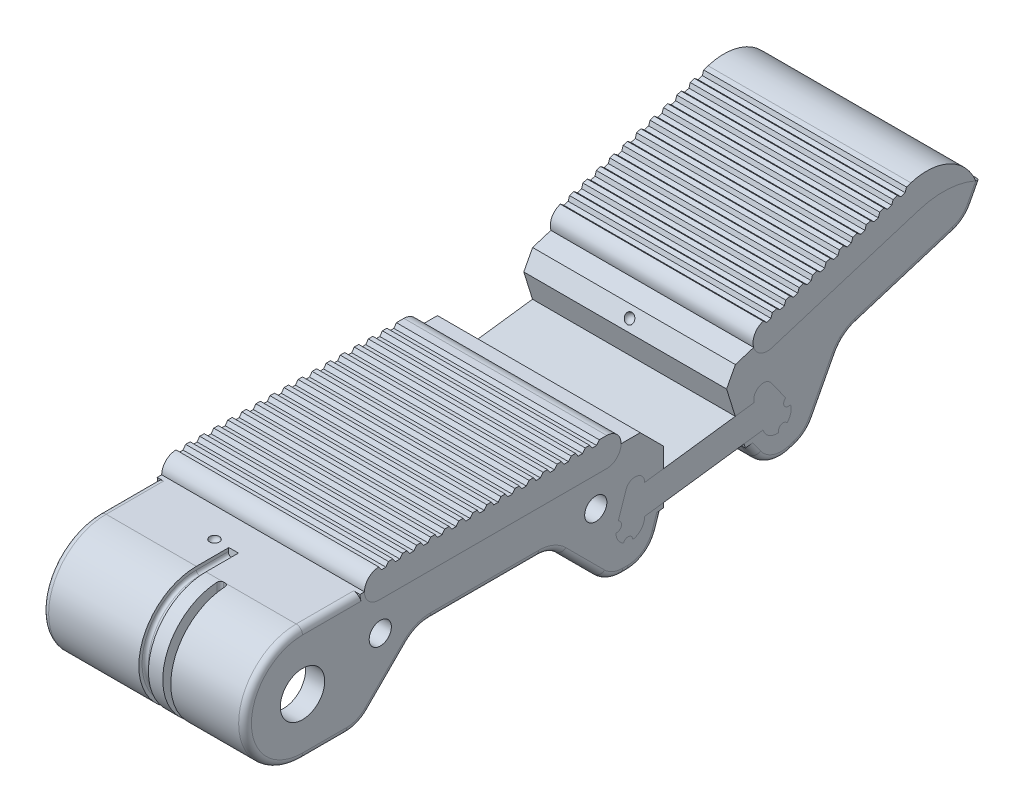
SolidWorks part; units mm, degrees
other "<finger_pivot_print>-<Contouring>"
ref_plane "Front Plane" through (0, 0, 0) normal (0, 0, 1) x (1, 0, 0)
ref_plane "Top Plane" through (0, 0, 0) normal (0, 1, 0) x (1, 0, 0)
ref_plane "Right Plane" through (0, 0, 0) normal (1, 0, 0) x (0, 0, -1)
inserted part "finger_pivot_print"
sketch "Sketch1" plane through (15.875, 0, 0) normal (1, 0, 0) x (0, 0, -1)
  line L4 (53.5721, -2.6914) -> (72.1051, -0.2514)
  line L5 (50.6498, 2.3847) -> (49.4269, -1.2655)
  line L6 (70.731, 4.1672) -> (53.5721, 1.9082)
  line L7 (75.6436, 2.3384) -> (73.3817, 5.4877)
  line L8 (53.5721, -2.6914) -> (72.1051, -0.2514)
  line L9 (50.6498, 2.3847) -> (49.4269, -1.2655)
  line L10 (70.731, 4.1672) -> (53.5721, 1.9082)
  line L11 (75.6436, 2.3384) -> (73.3817, 5.4877)
  line L45 (72.6711, 14.0607) -> (72.1185, 14.4905)
  line L46 (73.3395, 14.2686) -> (72.6711, 14.0607)
  line L47 (73.5509, 14.9359) -> (73.3395, 14.2686)
  line L48 (74.2193, 15.1438) -> (73.5509, 14.9359)
  line L49 (74.7718, 14.714) -> (74.2193, 15.1438)
  line L50 (75.4402, 14.9219) -> (74.7718, 14.714)
  line L51 (75.6516, 15.5892) -> (75.4402, 14.9219)
  line L52 (76.32, 15.7971) -> (75.6516, 15.5892)
  line L53 (76.8726, 15.3673) -> (76.32, 15.7971)
  line L54 (77.541, 15.5752) -> (76.8726, 15.3673)
  line L55 (77.7524, 16.2425) -> (77.541, 15.5752)
  line L56 (78.4208, 16.4504) -> (77.7524, 16.2425)
  line L57 (78.9733, 16.0206) -> (78.4208, 16.4504)
  line L58 (79.6418, 16.2285) -> (78.9733, 16.0206)
  line L59 (79.8531, 16.8958) -> (79.6418, 16.2285)
  line L60 (80.5216, 17.1037) -> (79.8531, 16.8958)
  line L61 (81.0741, 16.6739) -> (80.5216, 17.1037)
  line L62 (81.7425, 16.8818) -> (81.0741, 16.6739)
  line L63 (81.9539, 17.5491) -> (81.7425, 16.8818)
  line L64 (44.95, 11.25) -> (44.25, 11.25)
  line L65 (45.35, 10.6755) -> (44.95, 11.25)
  line L66 (46.05, 10.6755) -> (45.35, 10.6755)
  line L67 (46.45, 11.25) -> (46.05, 10.6755)
  line L68 (11.95, 6.75) -> (47.6241, 6.75)
  line L69 (12.35, 10.6755) -> (11.95, 11.25)
  line L70 (13.05, 10.6755) -> (12.35, 10.6755)
  line L71 (13.45, 11.25) -> (13.05, 10.6755)
  line L72 (14.15, 11.25) -> (13.45, 11.25)
  line L73 (14.55, 10.6755) -> (14.15, 11.25)
  line L74 (15.25, 10.6755) -> (14.55, 10.6755)
  line L75 (15.65, 11.25) -> (15.25, 10.6755)
  line L76 (16.35, 11.25) -> (15.65, 11.25)
  line L77 (16.75, 10.6755) -> (16.35, 11.25)
  line L78 (17.45, 10.6755) -> (16.75, 10.6755)
  line L79 (17.85, 11.25) -> (17.45, 10.6755)
  line L80 (18.55, 11.25) -> (17.85, 11.25)
  line L81 (18.95, 10.6755) -> (18.55, 11.25)
  line L82 (19.65, 10.6755) -> (18.95, 10.6755)
  line L83 (20.05, 11.25) -> (19.65, 10.6755)
  line L84 (20.75, 11.25) -> (20.05, 11.25)
  line L85 (21.15, 10.6755) -> (20.75, 11.25)
  line L86 (21.85, 10.6755) -> (21.15, 10.6755)
  line L87 (22.25, 11.25) -> (21.85, 10.6755)
  line L88 (22.95, 11.25) -> (22.25, 11.25)
  line L89 (23.35, 10.6755) -> (22.95, 11.25)
  line L90 (24.05, 10.6755) -> (23.35, 10.6755)
  line L91 (24.45, 11.25) -> (24.05, 10.6755)
  line L92 (25.15, 11.25) -> (24.45, 11.25)
  line L93 (25.55, 10.6755) -> (25.15, 11.25)
  line L94 (26.25, 10.6755) -> (25.55, 10.6755)
  line L95 (26.65, 11.25) -> (26.25, 10.6755)
  line L96 (27.35, 11.25) -> (26.65, 11.25)
  line L97 (27.75, 10.6755) -> (27.35, 11.25)
  line L98 (28.45, 10.6755) -> (27.75, 10.6755)
  line L99 (28.85, 11.25) -> (28.45, 10.6755)
  line L100 (29.55, 11.25) -> (28.85, 11.25)
  line L101 (29.95, 10.6755) -> (29.55, 11.25)
  line L102 (30.65, 10.6755) -> (29.95, 10.6755)
  line L103 (31.05, 11.25) -> (30.65, 10.6755)
  line L104 (31.75, 11.25) -> (31.05, 11.25)
  line L105 (32.15, 10.6755) -> (31.75, 11.25)
  line L106 (32.85, 10.6755) -> (32.15, 10.6755)
  line L107 (33.25, 11.25) -> (32.85, 10.6755)
  line L108 (33.95, 11.25) -> (33.25, 11.25)
  line L109 (34.35, 10.6755) -> (33.95, 11.25)
  line L110 (35.05, 10.6755) -> (34.35, 10.6755)
  line L111 (35.45, 11.25) -> (35.05, 10.6755)
  line L112 (36.15, 11.25) -> (35.45, 11.25)
  line L113 (36.55, 10.6755) -> (36.15, 11.25)
  line L114 (37.25, 10.6755) -> (36.55, 10.6755)
  line L115 (37.65, 11.25) -> (37.25, 10.6755)
  line L116 (38.35, 11.25) -> (37.65, 11.25)
  line L117 (38.75, 10.6755) -> (38.35, 11.25)
  line L118 (39.45, 10.6755) -> (38.75, 10.6755)
  line L119 (39.85, 11.25) -> (39.45, 10.6755)
  line L120 (40.55, 11.25) -> (39.85, 11.25)
  line L121 (40.95, 10.6755) -> (40.55, 11.25)
  line L122 (41.65, 10.6755) -> (40.95, 10.6755)
  line L123 (42.05, 11.25) -> (41.65, 10.6755)
  line L124 (42.75, 11.25) -> (42.05, 11.25)
  line L125 (43.15, 10.6755) -> (42.75, 11.25)
  line L126 (43.85, 10.6755) -> (43.15, 10.6755)
  line L127 (44.25, 11.25) -> (43.85, 10.6755)
  line L128 (44.95, 11.25) -> (44.25, 11.25)
  line L129 (45.35, 10.6755) -> (44.95, 11.25)
  line L130 (46.05, 10.6755) -> (45.35, 10.6755)
  line L131 (46.45, 11.25) -> (46.05, 10.6755)
  line L132 (11.95, 6.75) -> (47.6241, 6.75)
  line L133 (12.35, 10.6755) -> (11.95, 11.25)
  line L134 (13.05, 10.6755) -> (12.35, 10.6755)
  line L135 (13.45, 11.25) -> (13.05, 10.6755)
  line L136 (14.15, 11.25) -> (13.45, 11.25)
  line L137 (14.55, 10.6755) -> (14.15, 11.25)
  line L138 (15.25, 10.6755) -> (14.55, 10.6755)
  line L139 (15.65, 11.25) -> (15.25, 10.6755)
  line L140 (16.35, 11.25) -> (15.65, 11.25)
  line L141 (16.75, 10.6755) -> (16.35, 11.25)
  line L142 (17.45, 10.6755) -> (16.75, 10.6755)
  line L143 (17.85, 11.25) -> (17.45, 10.6755)
  line L144 (18.55, 11.25) -> (17.85, 11.25)
  line L145 (18.95, 10.6755) -> (18.55, 11.25)
  line L146 (19.65, 10.6755) -> (18.95, 10.6755)
  line L147 (20.05, 11.25) -> (19.65, 10.6755)
  line L148 (20.75, 11.25) -> (20.05, 11.25)
  line L149 (21.15, 10.6755) -> (20.75, 11.25)
  line L150 (21.85, 10.6755) -> (21.15, 10.6755)
  line L151 (22.25, 11.25) -> (21.85, 10.6755)
  line L152 (22.95, 11.25) -> (22.25, 11.25)
  line L153 (23.35, 10.6755) -> (22.95, 11.25)
  line L154 (24.05, 10.6755) -> (23.35, 10.6755)
  line L155 (24.45, 11.25) -> (24.05, 10.6755)
  line L156 (25.15, 11.25) -> (24.45, 11.25)
  line L157 (25.55, 10.6755) -> (25.15, 11.25)
  line L158 (26.25, 10.6755) -> (25.55, 10.6755)
  line L159 (26.65, 11.25) -> (26.25, 10.6755)
  line L160 (27.35, 11.25) -> (26.65, 11.25)
  line L161 (27.75, 10.6755) -> (27.35, 11.25)
  line L162 (28.45, 10.6755) -> (27.75, 10.6755)
  line L163 (28.85, 11.25) -> (28.45, 10.6755)
  line L164 (29.55, 11.25) -> (28.85, 11.25)
  line L165 (29.95, 10.6755) -> (29.55, 11.25)
  line L166 (30.65, 10.6755) -> (29.95, 10.6755)
  line L167 (31.05, 11.25) -> (30.65, 10.6755)
  line L168 (31.75, 11.25) -> (31.05, 11.25)
  line L169 (32.15, 10.6755) -> (31.75, 11.25)
  line L170 (32.85, 10.6755) -> (32.15, 10.6755)
  line L171 (33.25, 11.25) -> (32.85, 10.6755)
  line L172 (33.95, 11.25) -> (33.25, 11.25)
  line L173 (34.35, 10.6755) -> (33.95, 11.25)
  line L174 (35.05, 10.6755) -> (34.35, 10.6755)
  line L175 (35.45, 11.25) -> (35.05, 10.6755)
  line L176 (36.15, 11.25) -> (35.45, 11.25)
  line L177 (36.55, 10.6755) -> (36.15, 11.25)
  line L178 (37.25, 10.6755) -> (36.55, 10.6755)
  line L179 (37.65, 11.25) -> (37.25, 10.6755)
  line L180 (38.35, 11.25) -> (37.65, 11.25)
  line L181 (38.75, 10.6755) -> (38.35, 11.25)
  line L182 (39.45, 10.6755) -> (38.75, 10.6755)
  line L183 (39.85, 11.25) -> (39.45, 10.6755)
  line L184 (40.55, 11.25) -> (39.85, 11.25)
  line L185 (40.95, 10.6755) -> (40.55, 11.25)
  line L186 (41.65, 10.6755) -> (40.95, 10.6755)
  line L187 (42.05, 11.25) -> (41.65, 10.6755)
  line L188 (42.75, 11.25) -> (42.05, 11.25)
  line L189 (43.15, 10.6755) -> (42.75, 11.25)
  line L190 (43.85, 10.6755) -> (43.15, 10.6755)
  line L191 (44.25, 11.25) -> (43.85, 10.6755)
  line L192 (82.6223, 17.757) -> (81.9539, 17.5491)
  line L193 (83.1749, 17.3272) -> (82.6223, 17.757)
  line L194 (83.8433, 17.5351) -> (83.1749, 17.3272)
  line L195 (84.0547, 18.2024) -> (83.8433, 17.5351)
  line L196 (84.7231, 18.4102) -> (84.0547, 18.2024)
  line L197 (85.2756, 17.9805) -> (84.7231, 18.4102)
  line L198 (85.9441, 18.1883) -> (85.2756, 17.9805)
  line L199 (86.1554, 18.8557) -> (85.9441, 18.1883)
  line L200 (86.8239, 19.0635) -> (86.1554, 18.8557)
  line L201 (87.3764, 18.6338) -> (86.8239, 19.0635)
  line L202 (88.0448, 18.8416) -> (87.3764, 18.6338)
  line L203 (88.2562, 19.509) -> (88.0448, 18.8416)
  line L204 (88.9246, 19.7168) -> (88.2562, 19.509)
  line L205 (89.4772, 19.2871) -> (88.9246, 19.7168)
  line L206 (90.1456, 19.4949) -> (89.4772, 19.2871)
  line L207 (90.357, 20.1622) -> (90.1456, 19.4949)
  line L208 (91.0254, 20.3701) -> (90.357, 20.1622)
  line L209 (91.5779, 19.9403) -> (91.0254, 20.3701)
  line L210 (92.2464, 20.1482) -> (91.5779, 19.9403)
  line L211 (92.4577, 20.8155) -> (92.2464, 20.1482)
  line L212 (93.1262, 21.0234) -> (92.4577, 20.8155)
  line L213 (93.6787, 20.5936) -> (93.1262, 21.0234)
  line L214 (94.3471, 20.8015) -> (93.6787, 20.5936)
  line L215 (94.5585, 21.4688) -> (94.3471, 20.8015)
  line L216 (95.2522, 21.6845) -> (94.5585, 21.4688)
  line L217 (73.4548, 10.1935) -> (96.5884, 17.3875)
  line L218 (72.6711, 14.0607) -> (72.1185, 14.4905)
  line L219 (73.3395, 14.2686) -> (72.6711, 14.0607)
  line L220 (73.5509, 14.9359) -> (73.3395, 14.2686)
  line L221 (74.2193, 15.1438) -> (73.5509, 14.9359)
  line L222 (74.7718, 14.714) -> (74.2193, 15.1438)
  line L223 (75.4402, 14.9219) -> (74.7718, 14.714)
  line L224 (75.6516, 15.5892) -> (75.4402, 14.9219)
  line L225 (76.32, 15.7971) -> (75.6516, 15.5892)
  line L226 (76.8726, 15.3673) -> (76.32, 15.7971)
  line L227 (77.541, 15.5752) -> (76.8726, 15.3673)
  line L228 (77.7524, 16.2425) -> (77.541, 15.5752)
  line L229 (78.4208, 16.4504) -> (77.7524, 16.2425)
  line L230 (78.9733, 16.0206) -> (78.4208, 16.4504)
  line L231 (79.6418, 16.2285) -> (78.9733, 16.0206)
  line L232 (79.8531, 16.8958) -> (79.6418, 16.2285)
  line L233 (80.5216, 17.1037) -> (79.8531, 16.8958)
  line L234 (81.0741, 16.6739) -> (80.5216, 17.1037)
  line L235 (81.7425, 16.8818) -> (81.0741, 16.6739)
  line L236 (81.9539, 17.5491) -> (81.7425, 16.8818)
  line L237 (82.6223, 17.757) -> (81.9539, 17.5491)
  line L238 (83.1749, 17.3272) -> (82.6223, 17.757)
  line L239 (83.8433, 17.5351) -> (83.1749, 17.3272)
  line L240 (84.0547, 18.2024) -> (83.8433, 17.5351)
  line L241 (84.7231, 18.4102) -> (84.0547, 18.2024)
  line L242 (85.2756, 17.9805) -> (84.7231, 18.4102)
  line L243 (85.9441, 18.1883) -> (85.2756, 17.9805)
  line L244 (86.1554, 18.8557) -> (85.9441, 18.1883)
  line L245 (86.8239, 19.0635) -> (86.1554, 18.8557)
  line L246 (87.3764, 18.6338) -> (86.8239, 19.0635)
  line L247 (88.0448, 18.8416) -> (87.3764, 18.6338)
  line L248 (88.2562, 19.509) -> (88.0448, 18.8416)
  line L249 (88.9246, 19.7168) -> (88.2562, 19.509)
  line L250 (89.4772, 19.2871) -> (88.9246, 19.7168)
  line L251 (90.1456, 19.4949) -> (89.4772, 19.2871)
  line L252 (90.357, 20.1622) -> (90.1456, 19.4949)
  line L253 (91.0254, 20.3701) -> (90.357, 20.1622)
  line L254 (91.5779, 19.9403) -> (91.0254, 20.3701)
  line L255 (92.2464, 20.1482) -> (91.5779, 19.9403)
  line L256 (92.4577, 20.8155) -> (92.2464, 20.1482)
  line L257 (93.1262, 21.0234) -> (92.4577, 20.8155)
  line L258 (93.6787, 20.5936) -> (93.1262, 21.0234)
  line L259 (94.3471, 20.8015) -> (93.6787, 20.5936)
  line L260 (94.5585, 21.4688) -> (94.3471, 20.8015)
  line L261 (95.2522, 21.6845) -> (94.5585, 21.4688)
  line L262 (73.4548, 10.1935) -> (96.5884, 17.3875)
  line L291 (47.6241, 11.25) -> (46.45, 11.25)
  line L292 (47.6241, 11.25) -> (46.45, 11.25)
  arc A3 (47.6241, 6.75) -> (47.6241, 11.25) centre (47.6241, 9) ccw
  arc A4 (11.95, 11.25) -> (11.95, 6.75) centre (11.95, 9) ccw
  arc A5 (47.6241, 6.75) -> (47.6241, 11.25) centre (47.6241, 9) ccw
  arc A6 (11.95, 11.25) -> (11.95, 6.75) centre (11.95, 9) ccw
  arc A9 (72.1185, 14.4905) -> (73.4548, 10.1935) centre (72.7866, 12.342) ccw
  arc A10 (105.4064, 16.8833) -> (95.2522, 21.6845) centre (97.7168, 13.7589) ccw
  arc A11 (105.4064, 16.8833) -> (96.5884, 17.3875) centre (100.3247, 5.3728) ccw
  arc A12 (72.1185, 14.4905) -> (73.4548, 10.1935) centre (72.7866, 12.342) ccw
  arc A13 (105.4064, 16.8833) -> (95.2522, 21.6845) centre (97.7168, 13.7589) ccw
  arc A14 (105.4064, 16.8833) -> (96.5884, 17.3875) centre (100.3247, 5.3728) ccw
  arc A23 (75.6436, 2.3384) -> (76.411, 1.0557) centre (76.0811, 1.7293) ccw
  arc A24 (75.8631, -1.1556) -> (76.411, 1.0557) centre (74.2537, 0.4167) ccw
  arc A25 (75.8631, -1.1556) -> (74.5393, -1.8151) centre (75.2569, -1.5972) ccw
  arc A26 (72.1051, -0.2514) -> (74.5393, -1.8151) centre (74.2537, 0.4167) ccw
  arc A27 (51.71, -4.9077) -> (53.5721, -2.6914) centre (51.3221, -2.6914) ccw
  arc A28 (51.71, -4.9077) -> (50.2502, -4.6697) centre (50.96, -4.912) ccw
  arc A29 (49.0722, -2.7175) -> (50.2502, -4.6697) centre (51.3221, -2.6914) ccw
  arc A30 (49.0722, -2.7175) -> (49.4269, -1.2655) centre (49.1886, -1.9766) ccw
  arc A31 (53.5721, 1.9082) -> (50.6498, 2.3847) centre (52.0721, 1.9082) ccw
  arc A32 (73.3817, 5.4877) -> (70.731, 4.1672) centre (72.1634, 4.6127) ccw
  arc A33 (75.6436, 2.3384) -> (76.411, 1.0557) centre (76.0811, 1.7293) ccw
  arc A34 (75.8631, -1.1556) -> (76.411, 1.0557) centre (74.2537, 0.4167) ccw
  arc A35 (75.8631, -1.1556) -> (74.5393, -1.8151) centre (75.2569, -1.5972) ccw
  arc A36 (72.1051, -0.2514) -> (74.5393, -1.8151) centre (74.2537, 0.4167) ccw
  arc A37 (51.71, -4.9077) -> (53.5721, -2.6914) centre (51.3221, -2.6914) ccw
  arc A38 (51.71, -4.9077) -> (50.2502, -4.6697) centre (50.96, -4.912) ccw
  arc A39 (49.0722, -2.7175) -> (50.2502, -4.6697) centre (51.3221, -2.6914) ccw
  arc A40 (49.0722, -2.7175) -> (49.4269, -1.2655) centre (49.1886, -1.9766) ccw
  arc A41 (53.5721, 1.9082) -> (50.6498, 2.3847) centre (52.0721, 1.9082) ccw
  arc A42 (73.3817, 5.4877) -> (70.731, 4.1672) centre (72.1634, 4.6127) ccw
  dimension "D1" = 0
  dimension "D2" = 0
  dimension "D3" = 0
extrude "Pad Material" add sketch "Sketch1" against normal up to surface (31.75 mm away) separate body
sketch "Sketch2" plane through (15.875, 0, 0) normal (1, 0, 0) x (0, 0, -1)
  line L0 (47.6241, 11.95) -> (11.95, 11.95) construction
  line L1 (95.0443, 22.353) -> (71.9106, 15.1589) construction
  line L2 (47.6241, 11.95) -> (11.95, 11.95)
  line L3 (95.0443, 22.353) -> (71.9106, 15.1589)
  line L4 (67.5458, 4.4539) -> (56.5464, 3.0058) construction
  line L5 (70.731, 4.1672) -> (53.5721, 1.9082) construction
  line L6 (53.5721, -2.6914) -> (72.1051, -0.2514) construction
  line L7 (55.4431, -3.1511) -> (70.4666, -1.1732) construction
  line L8 (67.5458, 4.4539) -> (56.5464, 3.0058)
  line L9 (67.7567, 3.7756) -> (56.5464, 2.2998)
  line L10 (56.5464, -2.2998) -> (69.1308, -0.643)
  line L11 (56.5464, -3.0058) -> (69.3417, -1.3213)
  line L12 (67.5458, 4.4539) -> (67.7567, 3.7756)
  line L13 (56.5464, 3.0058) -> (56.5464, 2.2998)
  line L14 (56.5464, 3.0058) -> (56.5464, 5.3277) construction
  line L15 (66.3939, 8.1581) -> (67.5458, 4.4539) construction
  line L16 (9.7, 9) -> (9, 9)
  line L17 (50.5741, 9) -> (49.8741, 9)
  line L18 (69.9697, 11.466) -> (70.6381, 11.6739)
  line L19 (105.4064, 16.8833) -> (106.3109, 16.4315)
  line L20 (69.1308, -0.643) -> (69.3417, -1.3213)
  line L21 (56.5464, -2.2998) -> (56.5464, -3.0058)
  line L49 (72.6711, 14.0607) -> (72.1185, 14.4905)
  line L50 (73.3395, 14.2686) -> (72.6711, 14.0607)
  line L51 (73.5509, 14.9359) -> (73.3395, 14.2686)
  line L52 (74.2193, 15.1438) -> (73.5509, 14.9359)
  line L53 (74.7718, 14.714) -> (74.2193, 15.1438)
  line L54 (75.4402, 14.9219) -> (74.7718, 14.714)
  line L55 (75.6516, 15.5892) -> (75.4402, 14.9219)
  line L56 (76.32, 15.7971) -> (75.6516, 15.5892)
  line L57 (76.8726, 15.3673) -> (76.32, 15.7971)
  line L58 (77.541, 15.5752) -> (76.8726, 15.3673)
  line L59 (77.7524, 16.2425) -> (77.541, 15.5752)
  line L60 (78.4208, 16.4504) -> (77.7524, 16.2425)
  line L61 (78.9733, 16.0206) -> (78.4208, 16.4504)
  line L62 (79.6418, 16.2285) -> (78.9733, 16.0206)
  line L63 (79.8531, 16.8958) -> (79.6418, 16.2285)
  line L64 (44.95, 11.25) -> (44.25, 11.25)
  line L65 (45.35, 10.6755) -> (44.95, 11.25)
  line L66 (46.05, 10.6755) -> (45.35, 10.6755)
  line L67 (46.45, 11.25) -> (46.05, 10.6755)
  line L68 (11.95, 6.75) -> (47.6241, 6.75)
  line L69 (12.35, 10.6755) -> (11.95, 11.25)
  line L70 (13.05, 10.6755) -> (12.35, 10.6755)
  line L71 (13.45, 11.25) -> (13.05, 10.6755)
  line L72 (14.15, 11.25) -> (13.45, 11.25)
  line L73 (14.55, 10.6755) -> (14.15, 11.25)
  line L74 (15.25, 10.6755) -> (14.55, 10.6755)
  line L75 (15.65, 11.25) -> (15.25, 10.6755)
  line L76 (16.35, 11.25) -> (15.65, 11.25)
  line L77 (16.75, 10.6755) -> (16.35, 11.25)
  line L78 (17.45, 10.6755) -> (16.75, 10.6755)
  line L79 (17.85, 11.25) -> (17.45, 10.6755)
  line L80 (18.55, 11.25) -> (17.85, 11.25)
  line L81 (18.95, 10.6755) -> (18.55, 11.25)
  line L82 (19.65, 10.6755) -> (18.95, 10.6755)
  line L83 (20.05, 11.25) -> (19.65, 10.6755)
  line L84 (20.75, 11.25) -> (20.05, 11.25)
  line L85 (21.15, 10.6755) -> (20.75, 11.25)
  line L86 (21.85, 10.6755) -> (21.15, 10.6755)
  line L87 (22.25, 11.25) -> (21.85, 10.6755)
  line L88 (22.95, 11.25) -> (22.25, 11.25)
  line L89 (23.35, 10.6755) -> (22.95, 11.25)
  line L90 (24.05, 10.6755) -> (23.35, 10.6755)
  line L91 (24.45, 11.25) -> (24.05, 10.6755)
  line L92 (25.15, 11.25) -> (24.45, 11.25)
  line L93 (25.55, 10.6755) -> (25.15, 11.25)
  line L94 (26.25, 10.6755) -> (25.55, 10.6755)
  line L95 (26.65, 11.25) -> (26.25, 10.6755)
  line L96 (27.35, 11.25) -> (26.65, 11.25)
  line L97 (27.75, 10.6755) -> (27.35, 11.25)
  line L98 (28.45, 10.6755) -> (27.75, 10.6755)
  line L99 (28.85, 11.25) -> (28.45, 10.6755)
  line L100 (29.55, 11.25) -> (28.85, 11.25)
  line L101 (29.95, 10.6755) -> (29.55, 11.25)
  line L102 (30.65, 10.6755) -> (29.95, 10.6755)
  line L103 (31.05, 11.25) -> (30.65, 10.6755)
  line L104 (31.75, 11.25) -> (31.05, 11.25)
  line L105 (32.15, 10.6755) -> (31.75, 11.25)
  line L106 (32.85, 10.6755) -> (32.15, 10.6755)
  line L107 (33.25, 11.25) -> (32.85, 10.6755)
  line L108 (33.95, 11.25) -> (33.25, 11.25)
  line L109 (34.35, 10.6755) -> (33.95, 11.25)
  line L110 (35.05, 10.6755) -> (34.35, 10.6755)
  line L111 (35.45, 11.25) -> (35.05, 10.6755)
  line L112 (36.15, 11.25) -> (35.45, 11.25)
  line L113 (36.55, 10.6755) -> (36.15, 11.25)
  line L114 (37.25, 10.6755) -> (36.55, 10.6755)
  line L115 (37.65, 11.25) -> (37.25, 10.6755)
  line L116 (38.35, 11.25) -> (37.65, 11.25)
  line L117 (38.75, 10.6755) -> (38.35, 11.25)
  line L118 (39.45, 10.6755) -> (38.75, 10.6755)
  line L119 (39.85, 11.25) -> (39.45, 10.6755)
  line L120 (40.55, 11.25) -> (39.85, 11.25)
  line L121 (40.95, 10.6755) -> (40.55, 11.25)
  line L122 (41.65, 10.6755) -> (40.95, 10.6755)
  line L123 (42.05, 11.25) -> (41.65, 10.6755)
  line L124 (42.75, 11.25) -> (42.05, 11.25)
  line L125 (43.15, 10.6755) -> (42.75, 11.25)
  line L126 (43.85, 10.6755) -> (43.15, 10.6755)
  line L127 (44.25, 11.25) -> (43.85, 10.6755)
  line L128 (44.95, 11.25) -> (44.25, 11.25)
  line L129 (45.35, 10.6755) -> (44.95, 11.25)
  line L130 (46.05, 10.6755) -> (45.35, 10.6755)
  line L131 (46.45, 11.25) -> (46.05, 10.6755)
  line L133 (12.35, 10.6755) -> (11.95, 11.25)
  line L134 (13.05, 10.6755) -> (12.35, 10.6755)
  line L135 (13.45, 11.25) -> (13.05, 10.6755)
  line L136 (14.15, 11.25) -> (13.45, 11.25)
  line L137 (14.55, 10.6755) -> (14.15, 11.25)
  line L138 (15.25, 10.6755) -> (14.55, 10.6755)
  line L139 (15.65, 11.25) -> (15.25, 10.6755)
  line L140 (16.35, 11.25) -> (15.65, 11.25)
  line L141 (16.75, 10.6755) -> (16.35, 11.25)
  line L142 (17.45, 10.6755) -> (16.75, 10.6755)
  line L143 (17.85, 11.25) -> (17.45, 10.6755)
  line L144 (18.55, 11.25) -> (17.85, 11.25)
  line L145 (18.95, 10.6755) -> (18.55, 11.25)
  line L146 (19.65, 10.6755) -> (18.95, 10.6755)
  line L147 (20.05, 11.25) -> (19.65, 10.6755)
  line L148 (20.75, 11.25) -> (20.05, 11.25)
  line L149 (21.15, 10.6755) -> (20.75, 11.25)
  line L150 (21.85, 10.6755) -> (21.15, 10.6755)
  line L151 (22.25, 11.25) -> (21.85, 10.6755)
  line L152 (22.95, 11.25) -> (22.25, 11.25)
  line L153 (23.35, 10.6755) -> (22.95, 11.25)
  line L154 (24.05, 10.6755) -> (23.35, 10.6755)
  line L155 (24.45, 11.25) -> (24.05, 10.6755)
  line L156 (25.15, 11.25) -> (24.45, 11.25)
  line L157 (25.55, 10.6755) -> (25.15, 11.25)
  line L158 (26.25, 10.6755) -> (25.55, 10.6755)
  line L159 (26.65, 11.25) -> (26.25, 10.6755)
  line L160 (27.35, 11.25) -> (26.65, 11.25)
  line L161 (27.75, 10.6755) -> (27.35, 11.25)
  line L162 (28.45, 10.6755) -> (27.75, 10.6755)
  line L163 (28.85, 11.25) -> (28.45, 10.6755)
  line L164 (29.55, 11.25) -> (28.85, 11.25)
  line L165 (29.95, 10.6755) -> (29.55, 11.25)
  line L166 (30.65, 10.6755) -> (29.95, 10.6755)
  line L167 (31.05, 11.25) -> (30.65, 10.6755)
  line L168 (31.75, 11.25) -> (31.05, 11.25)
  line L169 (32.15, 10.6755) -> (31.75, 11.25)
  line L170 (32.85, 10.6755) -> (32.15, 10.6755)
  line L171 (33.25, 11.25) -> (32.85, 10.6755)
  line L172 (33.95, 11.25) -> (33.25, 11.25)
  line L173 (34.35, 10.6755) -> (33.95, 11.25)
  line L174 (35.05, 10.6755) -> (34.35, 10.6755)
  line L175 (35.45, 11.25) -> (35.05, 10.6755)
  line L176 (36.15, 11.25) -> (35.45, 11.25)
  line L177 (36.55, 10.6755) -> (36.15, 11.25)
  line L178 (37.25, 10.6755) -> (36.55, 10.6755)
  line L179 (37.65, 11.25) -> (37.25, 10.6755)
  line L180 (38.35, 11.25) -> (37.65, 11.25)
  line L181 (38.75, 10.6755) -> (38.35, 11.25)
  line L182 (39.45, 10.6755) -> (38.75, 10.6755)
  line L183 (39.85, 11.25) -> (39.45, 10.6755)
  line L184 (40.55, 11.25) -> (39.85, 11.25)
  line L185 (40.95, 10.6755) -> (40.55, 11.25)
  line L186 (41.65, 10.6755) -> (40.95, 10.6755)
  line L187 (42.05, 11.25) -> (41.65, 10.6755)
  line L188 (42.75, 11.25) -> (42.05, 11.25)
  line L189 (43.15, 10.6755) -> (42.75, 11.25)
  line L190 (43.85, 10.6755) -> (43.15, 10.6755)
  line L191 (44.25, 11.25) -> (43.85, 10.6755)
  line L192 (80.5216, 17.1037) -> (79.8531, 16.8958)
  line L193 (81.0741, 16.6739) -> (80.5216, 17.1037)
  line L194 (81.7425, 16.8818) -> (81.0741, 16.6739)
  line L195 (81.9539, 17.5491) -> (81.7425, 16.8818)
  line L196 (82.6223, 17.757) -> (81.9539, 17.5491)
  line L197 (83.1749, 17.3272) -> (82.6223, 17.757)
  line L198 (83.8433, 17.5351) -> (83.1749, 17.3272)
  line L199 (84.0547, 18.2024) -> (83.8433, 17.5351)
  line L200 (84.7231, 18.4102) -> (84.0547, 18.2024)
  line L201 (85.2756, 17.9805) -> (84.7231, 18.4102)
  line L202 (85.9441, 18.1883) -> (85.2756, 17.9805)
  line L203 (86.1554, 18.8557) -> (85.9441, 18.1883)
  line L204 (86.8239, 19.0635) -> (86.1554, 18.8557)
  line L205 (87.3764, 18.6338) -> (86.8239, 19.0635)
  line L206 (88.0448, 18.8416) -> (87.3764, 18.6338)
  line L207 (88.2562, 19.509) -> (88.0448, 18.8416)
  line L208 (88.9246, 19.7168) -> (88.2562, 19.509)
  line L209 (89.4772, 19.2871) -> (88.9246, 19.7168)
  line L210 (90.1456, 19.4949) -> (89.4772, 19.2871)
  line L211 (90.357, 20.1622) -> (90.1456, 19.4949)
  line L212 (91.0254, 20.3701) -> (90.357, 20.1622)
  line L213 (91.5779, 19.9403) -> (91.0254, 20.3701)
  line L214 (92.2464, 20.1482) -> (91.5779, 19.9403)
  line L215 (92.4577, 20.8155) -> (92.2464, 20.1482)
  line L216 (93.1262, 21.0234) -> (92.4577, 20.8155)
  line L217 (93.6787, 20.5936) -> (93.1262, 21.0234)
  line L218 (94.3471, 20.8015) -> (93.6787, 20.5936)
  line L219 (94.5585, 21.4688) -> (94.3471, 20.8015)
  line L220 (95.2522, 21.6845) -> (94.5585, 21.4688)
  line L221 (73.4548, 10.1935) -> (96.5884, 17.3875)
  line L222 (72.6711, 14.0607) -> (72.1185, 14.4905)
  line L223 (73.3395, 14.2686) -> (72.6711, 14.0607)
  line L224 (73.5509, 14.9359) -> (73.3395, 14.2686)
  line L225 (74.2193, 15.1438) -> (73.5509, 14.9359)
  line L226 (74.7718, 14.714) -> (74.2193, 15.1438)
  line L227 (75.4402, 14.9219) -> (74.7718, 14.714)
  line L228 (75.6516, 15.5892) -> (75.4402, 14.9219)
  line L229 (76.32, 15.7971) -> (75.6516, 15.5892)
  line L230 (76.8726, 15.3673) -> (76.32, 15.7971)
  line L231 (77.541, 15.5752) -> (76.8726, 15.3673)
  line L232 (77.7524, 16.2425) -> (77.541, 15.5752)
  line L233 (78.4208, 16.4504) -> (77.7524, 16.2425)
  line L234 (78.9733, 16.0206) -> (78.4208, 16.4504)
  line L235 (79.6418, 16.2285) -> (78.9733, 16.0206)
  line L236 (79.8531, 16.8958) -> (79.6418, 16.2285)
  line L237 (80.5216, 17.1037) -> (79.8531, 16.8958)
  line L238 (81.0741, 16.6739) -> (80.5216, 17.1037)
  line L239 (81.7425, 16.8818) -> (81.0741, 16.6739)
  line L240 (81.9539, 17.5491) -> (81.7425, 16.8818)
  line L241 (82.6223, 17.757) -> (81.9539, 17.5491)
  line L242 (83.1749, 17.3272) -> (82.6223, 17.757)
  line L243 (83.8433, 17.5351) -> (83.1749, 17.3272)
  line L244 (84.0547, 18.2024) -> (83.8433, 17.5351)
  line L245 (84.7231, 18.4102) -> (84.0547, 18.2024)
  line L246 (85.2756, 17.9805) -> (84.7231, 18.4102)
  line L247 (85.9441, 18.1883) -> (85.2756, 17.9805)
  line L248 (86.1554, 18.8557) -> (85.9441, 18.1883)
  line L249 (86.8239, 19.0635) -> (86.1554, 18.8557)
  line L250 (87.3764, 18.6338) -> (86.8239, 19.0635)
  line L251 (88.0448, 18.8416) -> (87.3764, 18.6338)
  line L252 (88.2562, 19.509) -> (88.0448, 18.8416)
  line L253 (88.9246, 19.7168) -> (88.2562, 19.509)
  line L254 (89.4772, 19.2871) -> (88.9246, 19.7168)
  line L255 (90.1456, 19.4949) -> (89.4772, 19.2871)
  line L256 (90.357, 20.1622) -> (90.1456, 19.4949)
  line L257 (91.0254, 20.3701) -> (90.357, 20.1622)
  line L258 (91.5779, 19.9403) -> (91.0254, 20.3701)
  line L259 (92.2464, 20.1482) -> (91.5779, 19.9403)
  line L260 (92.4577, 20.8155) -> (92.2464, 20.1482)
  line L261 (93.1262, 21.0234) -> (92.4577, 20.8155)
  line L262 (93.6787, 20.5936) -> (93.1262, 21.0234)
  line L263 (94.3471, 20.8015) -> (93.6787, 20.5936)
  line L264 (94.5585, 21.4688) -> (94.3471, 20.8015)
  line L265 (95.2522, 21.6845) -> (94.5585, 21.4688)
  line L303 (47.6241, 11.25) -> (46.45, 11.25)
  line L304 (47.6241, 11.25) -> (46.45, 11.25)
  arc A1 (11.95, 11.95) -> (9.1747, 8) centre (11.95, 9) ccw construction
  arc A2 (50.5741, 9) -> (47.6241, 11.95) centre (47.6241, 9) ccw construction
  arc A3 (47.6241, 6.75) -> (47.6241, 11.25) centre (47.6241, 9) ccw
  arc A4 (11.95, 11.25) -> (11.95, 6.75) centre (11.95, 9) ccw
  arc A5 (49.8741, 9) -> (47.6241, 11.25) centre (47.6241, 9) ccw
  arc A6 (11.95, 11.25) -> (9.7, 9) centre (11.95, 9) ccw
  arc A7 (71.9106, 15.1589) -> (69.9697, 11.466) centre (72.7866, 12.342) ccw construction
  arc A8 (105.8272, 17.6606) -> (95.0443, 22.353) centre (97.7168, 13.7589) ccw construction
  arc A9 (11.95, 11.95) -> (9, 9) centre (11.95, 9) ccw
  arc A10 (50.5741, 9) -> (47.6241, 11.95) centre (47.6241, 9) ccw
  arc A11 (71.9106, 15.1589) -> (69.9697, 11.466) centre (72.7866, 12.342) ccw
  arc A12 (105.8272, 17.6606) -> (95.0443, 22.353) centre (97.7168, 13.7589) ccw
  arc A14 (106.3109, 16.4315) -> (105.8272, 17.6606) centre (97.7168, 13.7589) ccw construction
  arc A15 (106.3109, 16.4315) -> (105.8272, 17.6606) centre (97.7168, 13.7589) ccw
  arc A17 (72.1185, 14.4905) -> (73.4548, 10.1935) centre (72.7866, 12.342) ccw
  arc A18 (105.4064, 16.8833) -> (95.2522, 21.6845) centre (97.7168, 13.7589) ccw
  arc A19 (105.4064, 16.8833) -> (96.5884, 17.3875) centre (100.3247, 5.3728) ccw
  arc A20 (72.1185, 14.4905) -> (70.6381, 11.6739) centre (72.7866, 12.342) ccw
  arc A21 (105.4064, 16.8833) -> (95.2522, 21.6845) centre (97.7168, 13.7589) ccw
  dimension "D1" = 0
  dimension "D2" = 0
extrude "Wall Removal" cut sketch "Sketch2" against normal through all
